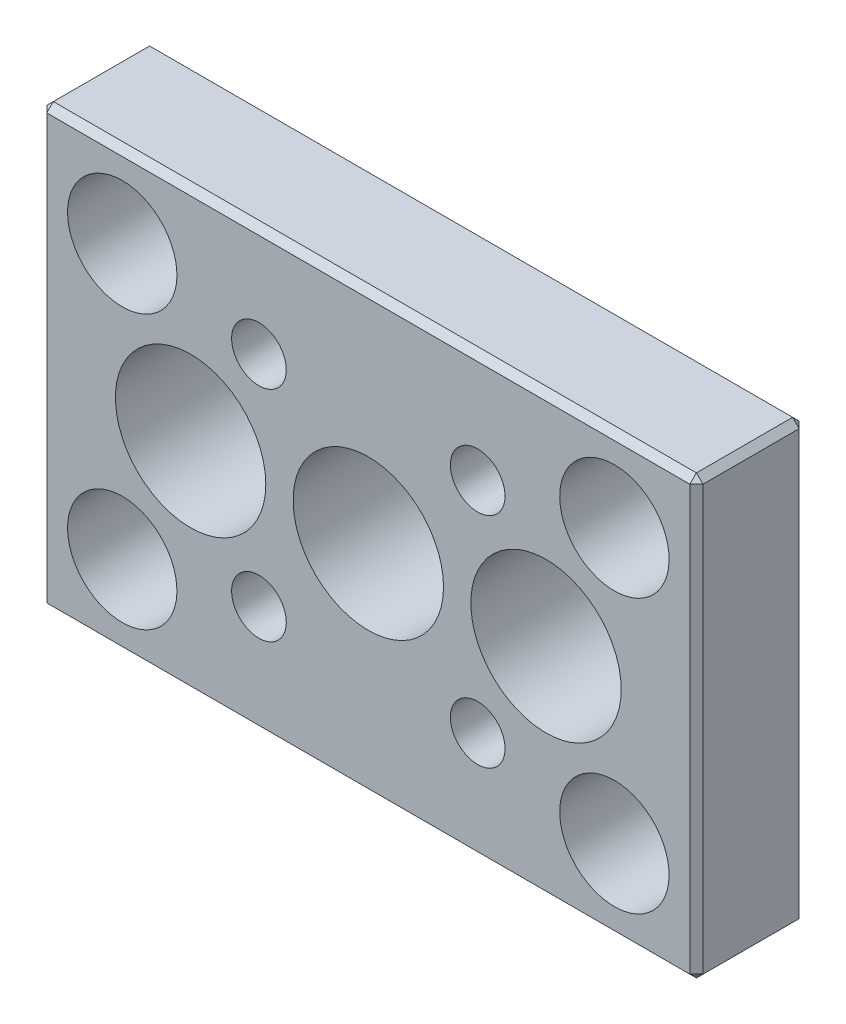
SolidWorks part; units mm, degrees
ref_plane "Front" through (0, 0, 0) normal (0, 0, 1) x (1, 0, 0)
ref_plane "Top" through (0, 0, 0) normal (0, 1, 0) x (1, 0, 0)
ref_plane "Right" through (0, 0, 0) normal (1, 0, 0) x (0, 0, -1)
sketch "Sketch1" plane through (0, 0, 0) normal (0, 0, 1) x (1, 0, 0)
  line L0 (76.2, 50.8) -> (-76.2, -50.8) construction
  line L1 (-76.2, 50.8) -> (76.2, 50.8)
  line L2 (-76.2, 50.8) -> (-76.2, -50.8)
  line L3 (-76.2, -50.8) -> (76.2, -50.8)
  line L4 (76.2, 50.8) -> (76.2, -50.8)
  point P4 (0, 0)
  dimension "D1" = 152.4
  dimension "D2" = 101.6
extrude "Extrude1" add sketch "Sketch1" against normal blind 25.4
sketch "Sketch2" plane through (0, 0, -25.4) normal (0, 0, -1) x (1, 0, 0)
  circle A0 centre (-25.4, -25.4) radius 6.35
  dimension "D2" = 12.7
  dimension "D1" = 25.4
  dimension "D3" = 25.4
extrude "Cut-Extrude2" cut sketch "Sketch2" against normal through all
pattern_linear "LPattern1" count 2 spacing 50.8 along (1, 0, 0) count 2 spacing 50.8 along (0, -1, 0) of "Cut-Extrude2"
sketch "Sketch3" plane through (0, 0, -25.4) normal (0, 0, -1) x (1, 0, 0)
  circle A0 centre (57.15, 31.75) radius 12.7
  dimension "D2" = 25.4
  dimension "D1" = 57.15
  dimension "D3" = 31.75
extrude "Cut-Extrude3" cut sketch "Sketch3" against normal through all
pattern_linear "LPattern2" count 2 spacing 63.5 along (0, 1, 0) count 2 spacing 114.3 along (-1, 0, 0) of "Cut-Extrude3"
chamfer "Chamfer1" distance 1.524 angle 45 12 edges at (0, -50.8, 0) (76.2, 0, 0) (0, 50.8, 0) (-76.2, 0, 0) (0, 50.8, -25.4) (76.2, 0, -25.4) (0, -50.8, -25.4) (-76.2, 0, -25.4) (76.2, 50.8, -12.7) (76.2, -50.8, -12.7) (-76.2, 50.8, -12.7) (-76.2, -50.8, -12.7)
sketch "Sketch4" plane through (0, 0, 0) normal (0, 0, 1) x (1, 0, 0)
  line L0 (0, 0) -> (60.96, 0) construction
  line L1 (0, 0) -> (0, 38.1) construction
  circle A0 centre (41.275, 0) radius 17.4625
  dimension "D1" = 34.925
  dimension "D2" = 41.275
extrude "Cut-Extrude5" cut sketch "Sketch4" against normal through all
pattern_linear "LPattern3" count 3 spacing 41.275 along (-1, 0, 0) of "Cut-Extrude5"
